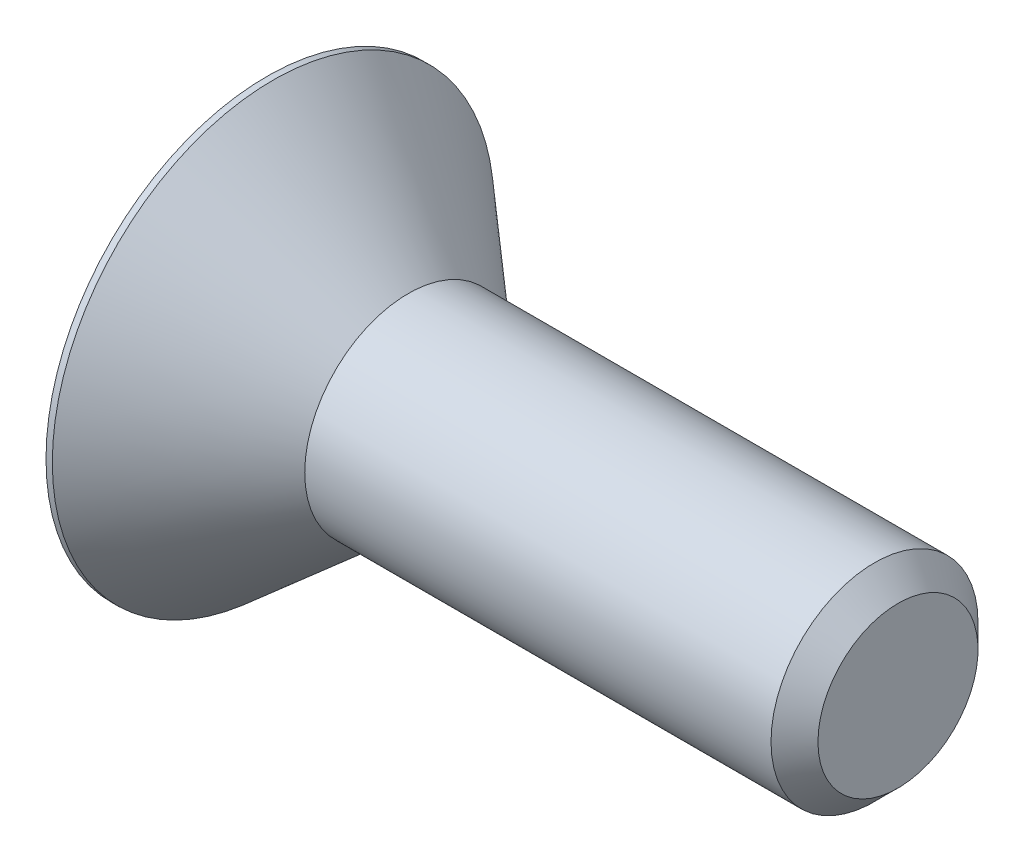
SolidWorks part; units mm, degrees
revolve "PreBroach" cut sketch "Sketch2"
sketch "Sketch2"
  line L0 (0, 1.1938) -> (1.9304, 1.1938)
  line L1 (1.9304, 1.1938) -> (2.6196, 0)
  line L2 (0, 0) -> (127, 0) construction
  line L3 (2.6196, 0) -> (0, 0)
  line L4 (0, 0) -> (0, 1.1938)
  line L5 (0, -1.1938) -> (1.9304, -1.1938) construction
  line L6 (0, 0) -> (47.625, 0) construction
  line L8 (0, 4.445) -> (0, -4.445) construction
revolve "BaseBody" add sketch "BodySke" angle 360 about L6
sketch "BodySke" plane through (0, 0, 0) normal (0, 0, 1) x (1, 0, 0)
  line L0 (0, 0) -> (0, 4.445)
  line L1 (0.127, 4.445) -> (2.8444, 2.0828)
  line L2 (0, 4.445) -> (0.127, 4.445)
  line L3 (2.8444, 2.0828) -> (12.2276, 2.0828)
  line L4 (12.7, 1.6104) -> (12.7, 0)
  line L5 (12.7, 0) -> (0, 0)
  line L6 (0, 0) -> (127, 0) construction
  line L7 (0.127, -4.445) -> (2.8444, -2.0828) construction
  line L8 (12.7, 1.6104) -> (12.2276, 2.0828)
  line L9 (0, -4.445) -> (0.127, -4.445) construction
  line L10 (12.7, -1.6104) -> (12.2276, -2.0828) construction
  line L11 (3.6369, 8.4328) -> (3.6369, -13.7922) construction
  line L12 (0, 19.05) -> (0, -3.175) construction
ref_plane "Plane1" through (0, 0, 0) normal (0, 0, 1) x (1, 0, 0)
ref_plane "Plane2" through (0, 0, 0) normal (0, 1, 0) x (1, 0, 0)
ref_plane "Plane3" through (0, 0, 0) normal (1, 0, 0) x (0, 0, -1)
sketch "Sketch3" plane through (0, 0, 0) normal (-1, 0, 0) x (0, 0, 1)
  line L0 (-1.1938, -0.6892) -> (-1.1938, 0.6892)
  line L1 (-1.1938, 0.6892) -> (0, 1.3785)
  line L2 (0, 1.3785) -> (1.1938, 0.6892)
  line L3 (1.1938, 0.6892) -> (1.1938, -0.6892)
  line L4 (1.1938, -0.6892) -> (0, -1.3785)
  line L5 (0, -1.3785) -> (-1.1938, -0.6892)
extrude "Hex" cut sketch "Sketch3" against normal blind 1.9304
sketch "Sketch4" plane through (0, 0, 0) normal (-1, 0, 0) x (0, 0, 1)
  line L0 (0, 0) -> (1.4605, 0)
  line L1 (0, 0) -> (6.1484, 3.5498) construction
  line L2 (0, 0) -> (0.7302, 1.2648)
  line L3 (1.2009, 0.3267) -> (1.3933, 0.4378)
  line L4 (0.8834, 0.8767) -> (1.0758, 0.9877)
  arc A0 (1.2009, 0.3267) -> (0.8834, 0.8767) centre (0, 0) ccw
  arc A1 (1.4605, 0) -> (1.3933, 0.4378) centre (0, 0) ccw
  arc A2 (0.7302, 1.2648) -> (1.0758, 0.9877) centre (0, 0) cw
extrude "Spline" [suppressed] cut sketch "Sketch4" against normal blind 1.9304
pattern_circular "CirPattern1" [suppressed] count 6 every 60 about axis through (0, 0, 0) along (1, 0, 0)
sketch "ThdSchSke" plane through (0, 0, 0) normal (0, 0, 1) x (1, 0, 0)
  line L0 (3.5099, -1.6104) -> (3.1791, -2.0828)
  line L1 (3.5099, -1.6104) -> (3.8407, -2.0828)
  line L2 (3.8407, -2.0828) -> (3.8407, -2.6035)
  line L3 (-3.175, 0) -> (5.1513, 0) construction
  line L4 (0, 4.445) -> (0, -4.445) construction
  line L5 (3.8407, -2.6035) -> (3.1791, -2.6035)
  line L6 (3.1791, -2.6035) -> (3.1791, -2.0828)
revolve "ThreadSchematic" [suppressed] cut sketch "ThdSchSke" angle 360 about L3
pattern_linear "ThdSchPat" [suppressed]
equation "\"D3@Sketch4\" = \"Spline_p_dim@Sketch4\" / 2"
equation "\"Thread_minor@ThreadCosmetic\"  =  \"Minor_dia@BodySke\""
equation "\"D2@CirPattern1\" = 360 / \"Num_teeth@CirPattern1\""
equation "\"D1@Sketch3\" = \"Hex_size@Sketch3\" / 2"
equation "\"D2@Sketch3\" = \"D1@Sketch3\""
equation "\"D3@Sketch3\" = \"Hex_size@Sketch3\""
equation "\"Thread_length@ThreadCosmetic\" = ((sgn( (\"Length@BodySke\" - \"Advance@BodySke\" - ( ( ( \"Head_dia@BodySke\" - \"Diameter@BodySke\" ) * 0.5 ) / tan( \"Head_ang@BodySke\" * 0.008726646 ) ) ) - \"Thread_nom@Body"
equation "\"Thread_minor@ThdSchSke\" = \"Minor_dia@BodySke\""
equation "\"Diameter@ThdSchSke\" = \"Diameter@BodySke\""
equation "\"Overcut@ThdSchSke\" = \"Diameter@BodySke\" * 1.25"
equation "\"Start@ThdSchSke\" = 0.000001 + \"Length@BodySke\" - \"Thread_length@ThreadCosmetic\"  '---Countersunk---"
equation "\"Num_threads@ThdSchPat\" = int( \"Thread_length@ThreadCosmetic\" / \"Advance@BodySke\" + 0.999 )  + 1"
equation "\"Advance@ThdSchPat\" = \"Thread_length@ThreadCosmetic\" /  (\"Num_threads@ThdSchPat\" - 1) 'relax it"
equation "\"Num_threads@ThdSchPat\" = \"Num_threads@ThdSchPat\" - sgn( \"Num_threads@ThdSchPat\" - 1) '---chamfered tips only---"
